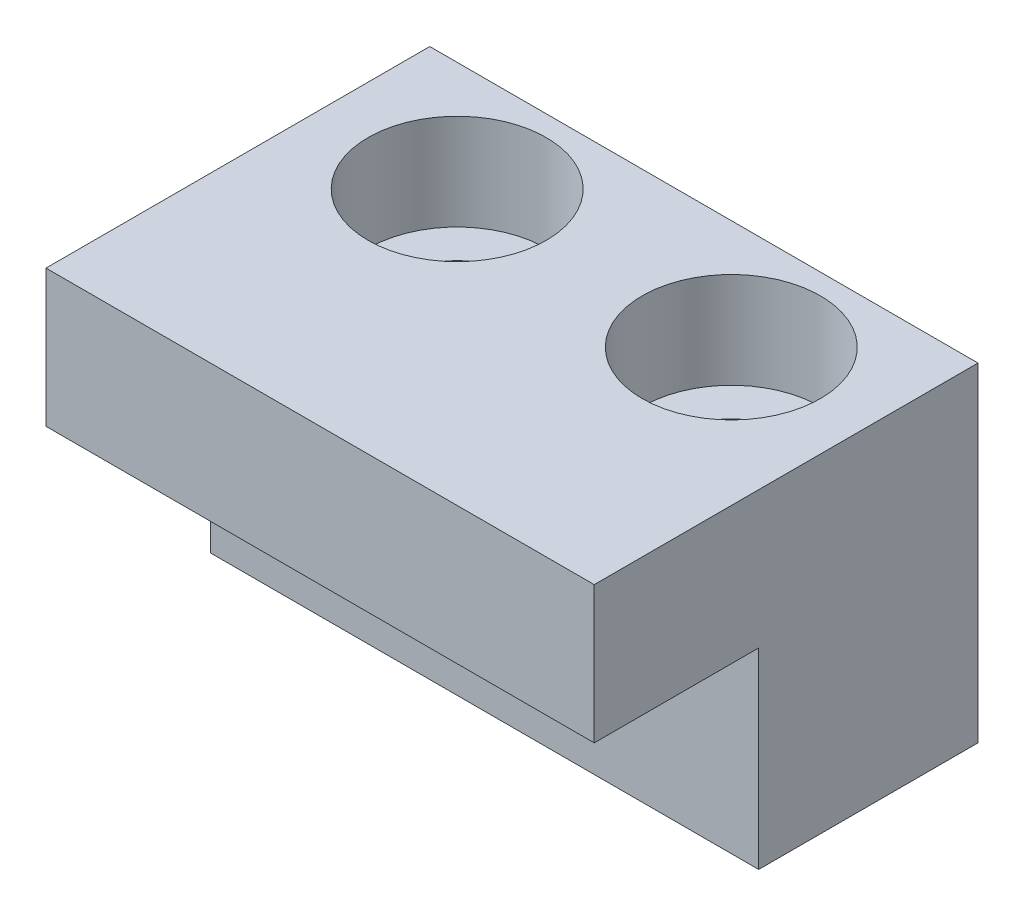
SolidWorks part; units mm, degrees
ref_plane "前视基准面" through (0, 0, 0) normal (0, 0, 1) x (1, 0, 0)
ref_plane "上视基准面" through (0, 0, 0) normal (0, 1, 0) x (1, 0, 0)
ref_plane "右视基准面" through (0, 0, 0) normal (1, 0, 0) x (0, 0, -1)
sketch "草图1" plane through (0, 0, 0) normal (0, 0, 1) x (1, 0, 0)
  line L0 (0, 0) -> (0, 12)
  line L1 (20, 0) -> (20, 12)
  line L2 (0, 0) -> (20, 0)
  line L3 (20, 12) -> (0, 12)
extrude "凸台-拉伸1" add sketch "草图1" along normal blind 14
sketch "草图2" plane through (20, 0, 0) normal (1, 0, 0) x (0, 0, -1)
  line L0 (-8, 0) -> (-8, 7)
  line L1 (-14, 7) -> (-8, 7)
extrude "切除-拉伸1" cut sketch "草图2" against normal through all and the other way through all flip side to cut
sketch "草图3" plane through (0, 12, 0) normal (0, 1, 0) x (1, 0, 0)
  circle A0 centre (5, -4) radius 1.75
  circle A1 centre (15, -4) radius 1.75
extrude "切除-拉伸2" cut sketch "草图3" against normal through all
sketch "草图4" plane through (0, 12, 0) normal (0, 1, 0) x (1, 0, 0)
  circle A0 centre (5, -4) radius 3.25
  circle A1 centre (15, -4) radius 3.25
extrude "切除-拉伸3" cut sketch "草图4" against normal blind 3.5
sketch "草图5" plane through (0, 12, 0) normal (0, 1, 0) x (1, 0, 0)
  circle A0 centre (5.5, -11) radius 2 construction
  circle A1 centre (14.5, -11) radius 2 construction
sketch "草图6" plane through (0, 7, 0) normal (0, -1, 0) x (1, 0, 0)
  circle A0 centre (5.5, 11) radius 2
  circle A1 centre (14.5, 11) radius 2
extrude "切除-拉伸4" cut sketch "草图6" against normal blind 3.5
